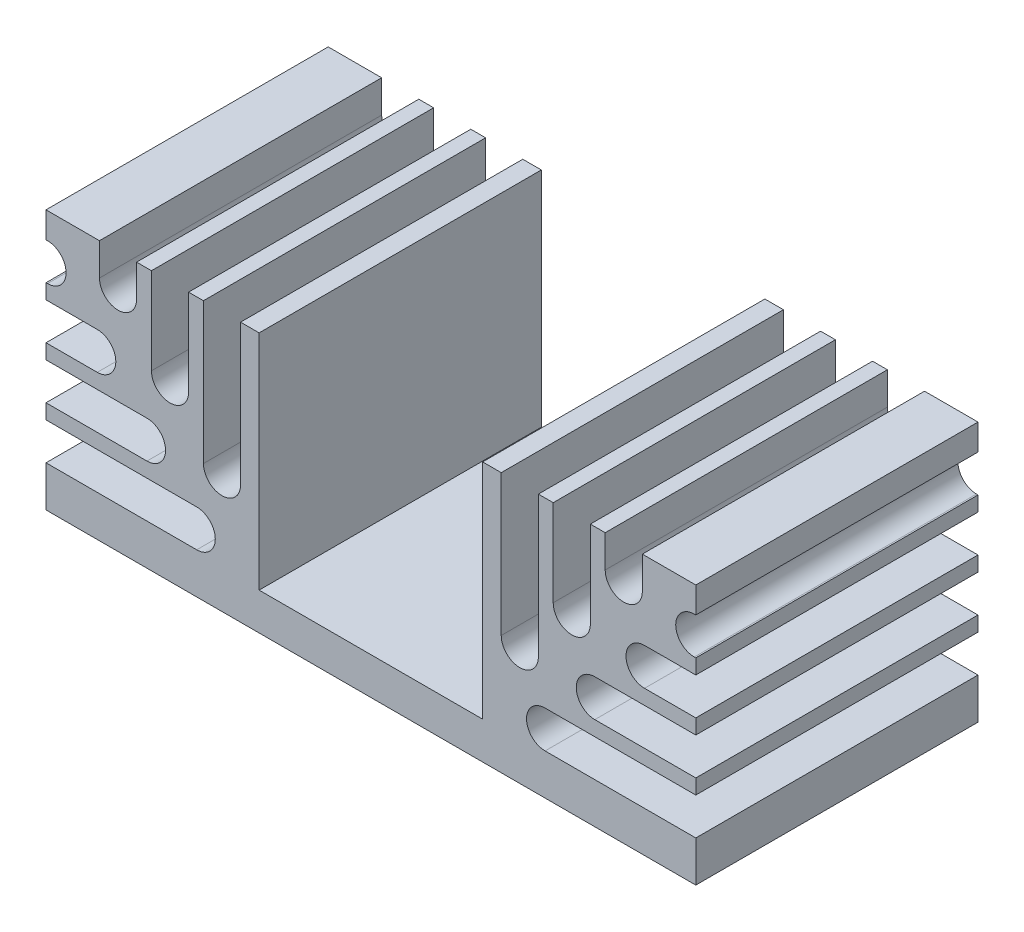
SolidWorks part; units mm, degrees
ref_plane "Přední rovina" through (0, 0, 0) normal (0, 0, 1) x (1, 0, 0)
ref_plane "Horní rovina" through (0, 0, 0) normal (0, 1, 0) x (1, 0, 0)
ref_plane "Pravá rovina" through (0, 0, 0) normal (1, 0, 0) x (0, 0, -1)
sketch "Skica1" plane through (0, 0, 0) normal (0, 0, 1) x (1, 0, 0)
  line L1 (-37.3294, 14.1889) -> (50.1706, 14.1889)
  line L2 (-37.3294, 14.1889) -> (-37.3294, -20.8111)
  line L3 (-37.3294, -20.8111) -> (50.1706, -20.8111)
  line L4 (50.1706, 14.1889) -> (50.1706, -20.8111)
  dimension "D1" = 87.5
  dimension "D2" = 35
extrude "Přidat vysunutím1" add sketch "Skica1" along normal blind 38
sketch "Skica3" plane through (0, 0, 38) normal (0, 0, 1) x (1, 0, 0)
  line L0 (-8.6294, 14.1889) -> (-8.6294, -15.8111)
  line L1 (50.1706, 14.1889) -> (-37.3294, 14.1889) construction
  line L2 (-8.6294, -15.8111) -> (21.4706, -15.8111)
  line L3 (21.4706, -15.8111) -> (21.4706, 14.1889)
  line L4 (-37.3294, -20.8111) -> (50.1706, -20.8111) construction
  line L5 (-37.3294, 14.1889) -> (-37.3294, -20.8111) construction
  line L6 (50.1706, -20.8111) -> (50.1706, 14.1889) construction
  line L7 (-13.6294, 16.0963) -> (-13.6294, -4.7983) construction
  line L8 (-11.1294, 16.0963) -> (-11.1294, -4.7983)
  line L9 (-16.1294, 16.0963) -> (-16.1294, -4.7983)
  line L10 (-39.368, -12.8111) -> (-17.035, -12.8111) construction
  line L11 (-39.368, -10.3111) -> (-17.035, -10.3111)
  line L12 (-39.368, -15.3111) -> (-17.035, -15.3111)
  line L13 (-20.6294, 16.9221) -> (-20.6294, 2.5188) construction
  line L14 (-18.1294, 16.9221) -> (-18.1294, 2.5188)
  line L15 (-23.1294, 16.9221) -> (-23.1294, 2.5188)
  line L16 (-42.9467, -5.8111) -> (-23.7317, -5.8111) construction
  line L17 (-42.9467, -3.3111) -> (-23.7317, -3.3111)
  line L18 (-42.9467, -8.3111) -> (-23.7317, -8.3111)
  line L19 (-41.295, 1.1889) -> (-30.4283, 1.1889) construction
  line L20 (-41.295, 3.6889) -> (-30.4283, 3.6889)
  line L21 (-41.295, -1.3111) -> (-30.4283, -1.3111)
  line L22 (-48.7595, 8.1889) -> (-37.125, 8.1889) construction
  line L23 (-48.7595, 10.6889) -> (-37.125, 10.6889)
  line L24 (-48.7595, 5.6889) -> (-37.125, 5.6889)
  line L25 (-27.6294, 9.8359) -> (-27.6294, 29.5156) construction
  line L26 (-30.1294, 9.8359) -> (-30.1294, 29.5156)
  line L27 (-25.1294, 9.8359) -> (-25.1294, 29.5156)
  line L28 (-34.6294, 17.153) -> (-34.6294, 29.7138) construction
  line L29 (-37.1294, 17.153) -> (-37.1294, 29.7138)
  line L30 (-32.1294, 17.153) -> (-32.1294, 29.7138)
  line L31 (-37.3294, 14.1889) -> (-8.6294, -15.8111) construction
  line L32 (6.4206, -15.8111) -> (6.4206, -20.8111) construction
  line L33 (-44.1861, 27.1426) -> (0.7207, -19.7983) construction
  line L34 (-41.8885, 13.1682) -> (-13.1885, -16.8318) construction
  line L35 (54.7298, 13.1682) -> (26.0298, -16.8318) construction
  line L36 (50.1706, 14.1889) -> (21.4706, -15.8111) construction
  line L38 (47.4706, 17.153) -> (47.4706, 29.7138) construction
  line L39 (49.9706, 17.153) -> (49.9706, 29.7138)
  line L40 (44.9706, 17.153) -> (44.9706, 29.7138)
  line L41 (40.4706, 9.8359) -> (40.4706, 29.5156) construction
  line L42 (42.9706, 9.8359) -> (42.9706, 29.5156)
  line L43 (37.9706, 9.8359) -> (37.9706, 29.5156)
  line L44 (61.6007, 8.1889) -> (49.9663, 8.1889) construction
  line L45 (61.6007, 10.6889) -> (49.9663, 10.6889)
  line L46 (61.6007, 5.6889) -> (49.9663, 5.6889)
  line L47 (54.1363, 1.1889) -> (43.2696, 1.1889) construction
  line L48 (54.1363, 3.6889) -> (43.2696, 3.6889)
  line L49 (54.1363, -1.3111) -> (43.2696, -1.3111)
  line L50 (55.788, -5.8111) -> (36.5729, -5.8111) construction
  line L51 (55.788, -3.3111) -> (36.5729, -3.3111)
  line L52 (55.788, -8.3111) -> (36.5729, -8.3111)
  line L53 (33.4706, 16.9221) -> (33.4706, 2.5188) construction
  line L54 (30.9706, 16.9221) -> (30.9706, 2.5188)
  line L55 (35.9706, 16.9221) -> (35.9706, 2.5188)
  line L56 (52.2093, -12.8111) -> (29.8763, -12.8111) construction
  line L57 (52.2093, -10.3111) -> (29.8763, -10.3111)
  line L58 (52.2093, -15.3111) -> (29.8763, -15.3111)
  line L59 (26.4706, 16.0963) -> (26.4706, -4.7983) construction
  line L60 (23.9706, 16.0963) -> (23.9706, -4.7983)
  line L61 (28.9706, 16.0963) -> (28.9706, -4.7983)
  arc A0 (-11.1294, 16.0963) -> (-16.1294, 16.0963) centre (-13.6294, 16.0963) ccw
  arc A1 (-16.1294, -4.7983) -> (-11.1294, -4.7983) centre (-13.6294, -4.7983) ccw
  arc A2 (-39.368, -10.3111) -> (-39.368, -15.3111) centre (-39.368, -12.8111) ccw
  arc A3 (-17.035, -15.3111) -> (-17.035, -10.3111) centre (-17.035, -12.8111) ccw
  arc A4 (-18.1294, 16.9221) -> (-23.1294, 16.9221) centre (-20.6294, 16.9221) ccw
  arc A5 (-23.1294, 2.5188) -> (-18.1294, 2.5188) centre (-20.6294, 2.5188) ccw
  arc A6 (-42.9467, -3.3111) -> (-42.9467, -8.3111) centre (-42.9467, -5.8111) ccw
  arc A7 (-23.7317, -8.3111) -> (-23.7317, -3.3111) centre (-23.7317, -5.8111) ccw
  arc A8 (-41.295, 3.6889) -> (-41.295, -1.3111) centre (-41.295, 1.1889) ccw
  arc A9 (-30.4283, -1.3111) -> (-30.4283, 3.6889) centre (-30.4283, 1.1889) ccw
  arc A10 (-48.7595, 10.6889) -> (-48.7595, 5.6889) centre (-48.7595, 8.1889) ccw
  arc A11 (-37.125, 5.6889) -> (-37.125, 10.6889) centre (-37.125, 8.1889) ccw
  arc A12 (-30.1294, 9.8359) -> (-25.1294, 9.8359) centre (-27.6294, 9.8359) ccw
  arc A13 (-25.1294, 29.5156) -> (-30.1294, 29.5156) centre (-27.6294, 29.5156) ccw
  arc A14 (-37.1294, 17.153) -> (-32.1294, 17.153) centre (-34.6294, 17.153) ccw
  arc A15 (-32.1294, 29.7138) -> (-37.1294, 29.7138) centre (-34.6294, 29.7138) ccw
  arc A16 (49.9706, 17.153) -> (44.9706, 17.153) centre (47.4706, 17.153) cw
  arc A17 (44.9706, 29.7138) -> (49.9706, 29.7138) centre (47.4706, 29.7138) cw
  arc A18 (42.9706, 9.8359) -> (37.9706, 9.8359) centre (40.4706, 9.8359) cw
  arc A19 (37.9706, 29.5156) -> (42.9706, 29.5156) centre (40.4706, 29.5156) cw
  arc A20 (61.6007, 10.6889) -> (61.6007, 5.6889) centre (61.6007, 8.1889) cw
  arc A21 (49.9663, 5.6889) -> (49.9663, 10.6889) centre (49.9663, 8.1889) cw
  arc A22 (54.1363, 3.6889) -> (54.1363, -1.3111) centre (54.1363, 1.1889) cw
  arc A23 (43.2696, -1.3111) -> (43.2696, 3.6889) centre (43.2696, 1.1889) cw
  arc A24 (55.788, -3.3111) -> (55.788, -8.3111) centre (55.788, -5.8111) cw
  arc A25 (36.5729, -8.3111) -> (36.5729, -3.3111) centre (36.5729, -5.8111) cw
  arc A26 (30.9706, 16.9221) -> (35.9706, 16.9221) centre (33.4706, 16.9221) cw
  arc A27 (35.9706, 2.5188) -> (30.9706, 2.5188) centre (33.4706, 2.5188) cw
  arc A28 (52.2093, -10.3111) -> (52.2093, -15.3111) centre (52.2093, -12.8111) cw
  arc A29 (29.8763, -15.3111) -> (29.8763, -10.3111) centre (29.8763, -12.8111) cw
  arc A30 (23.9706, 16.0963) -> (28.9706, 16.0963) centre (26.4706, 16.0963) cw
  arc A31 (28.9706, -4.7983) -> (23.9706, -4.7983) centre (26.4706, -4.7983) cw
  point P14 (-13.6294, 5.649)
  point P21 (-28.2015, -12.8111)
  point P26 (-20.6294, 9.7205)
  point P33 (-33.3392, -5.8111)
  point P41 (-35.8617, 1.1889)
  point P49 (-42.9422, 8.1889)
  point P55 (-27.6294, 19.6758)
  point P62 (-34.6294, 23.4334)
  point P81 (47.4706, 23.4334)
  point P88 (40.4706, 19.6758)
  point P95 (55.7835, 8.1889)
  point P102 (48.7029, 1.1889)
  point P109 (46.1805, -5.8111)
  point P116 (33.4706, 9.7205)
  point P123 (41.0428, -12.8111)
  point P130 (26.4706, 5.649)
  dimension "D4" = 8
  dimension "D8" = 7
  dimension "D9" = 5
  dimension "D10" = 7
  dimension "D7" = 7
  dimension "D1" = 5
  dimension "D2" = 28.7
  dimension "D3" = 28.7
  dimension "D5" = 7
  dimension "D6" = 7
  dimension "D11" = 7
  dimension "D12" = 4
  dimension "D13" = 4
extrude "Odebrat vysunutím1" cut sketch "Skica3" against normal through all contours L15 A5 L14 M4 | L9 A1 L8 M4 | L2 L3 L0 M4 | L26 A12 L27 M4 | L24 A11 L23 M1 | L21 A9 L20 M1 | L12 A3 L11 M1 | A21 L46 L45 M3 | A18 L42 L43 M4 | A27 L55 L54 M4 | A31 L61 L60 M4 | A23 L49 L48 M3 | A25 L52 L51 M3 | A29 L58 L57 M3 | L17 A7 L18 A6
sketch "Skica4" plane through (0, -20.8111, 0) normal (0, -1, 0) x (1, 0, 0)
  line L0 (-37.3294, 0) -> (50.1706, 0) construction
  line L1 (50.1706, 38) -> (50.1706, 0) construction
  line L2 (-37.3294, 38) -> (-37.3294, 0) construction
  circle A0 centre (-17.3294, 5) radius 1.7471
  circle A1 centre (40.1706, 5) radius 1.75
  dimension "D1" = 5
  dimension "D2" = 10
  dimension "D3" = 5
  dimension "D4" = 20
hole_wizard "M3x0.5 závit1" positions "Skica6" profile "Skica5" tap size "M3x0.5" standard "ANSI Metric"
sketch "Skica6" plane through (0, -20.8111, 0) normal (0, -1, 0) x (-1, 0, 0)
  point P0 (17.3294, -5)
  point P3 (-40.1706, -5)
sketch "Skica5" plane through (-17.3294, -20.8111, 5) normal (1, 0, 0) x (0, 0, -1)
  line L0 (0, 0) -> (0, 9.2511)
  line L1 (0, 9.2511) -> (1.25, 8.5)
  line L2 (1.25, 8.5) -> (1.25, 0)
  line L5 (1.25, 0) -> (0, 0)
  line L10 (0, 9.2511) -> (-1.25, 8.5) construction
  line L11 (0, -6.35) -> (0, 107.95) construction
  dimension "Průměr závitníku" = 2.5
  dimension "Hloubka závitníku" = 8.5
  dimension "Úhel vrtání" = 118
